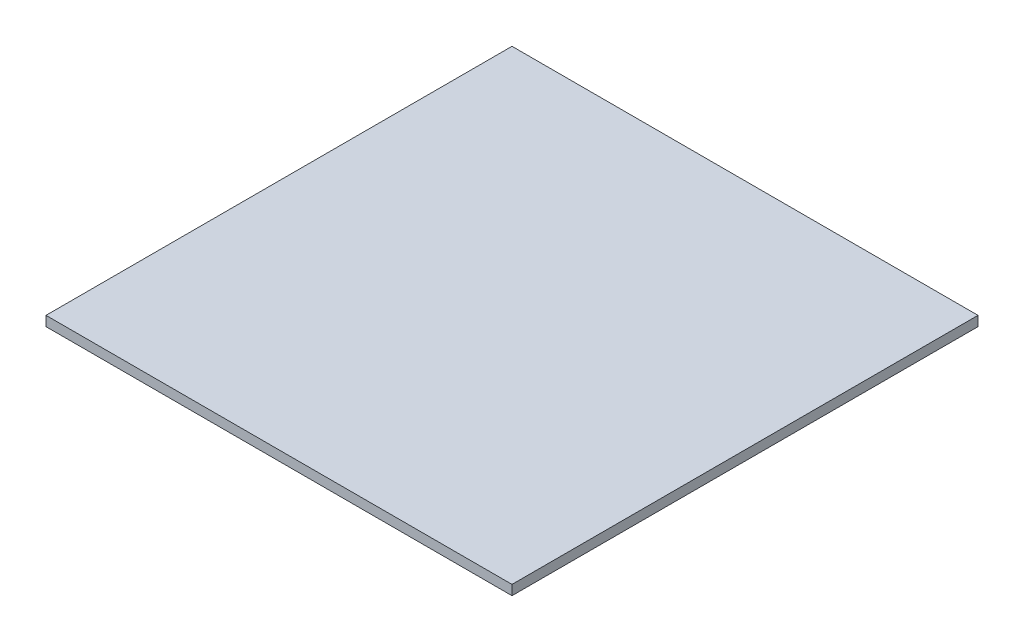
SolidWorks part; units mm, degrees
ref_plane "Front Plane" through (0, 0, 0) normal (0, 0, 1) x (1, 0, 0)
ref_plane "Top Plane" through (0, 0, 0) normal (0, 1, 0) x (1, 0, 0)
ref_plane "Right Plane" through (0, 0, 0) normal (1, 0, 0) x (0, 0, -1)
sketch "Sketch1" plane through (0, 0, 0) normal (0, 1, 0) x (1, 0, 0)
  line L1 (47.5, 47.5) -> (-47.5, 47.5)
  line L2 (47.5, 47.5) -> (47.5, -47.5)
  line L3 (47.5, -47.5) -> (-47.5, -47.5)
  line L4 (-47.5, 47.5) -> (-47.5, -47.5)
  line L5 (47.5, 47.5) -> (-47.5, -47.5) construction
  line L6 (47.5, -47.5) -> (-47.5, 47.5) construction
  point P0 (0, 0)
  dimension "D1" = 95
  dimension "D2" = 95
extrude "Boss-Extrude1" add sketch "Sketch1" along normal blind 2
